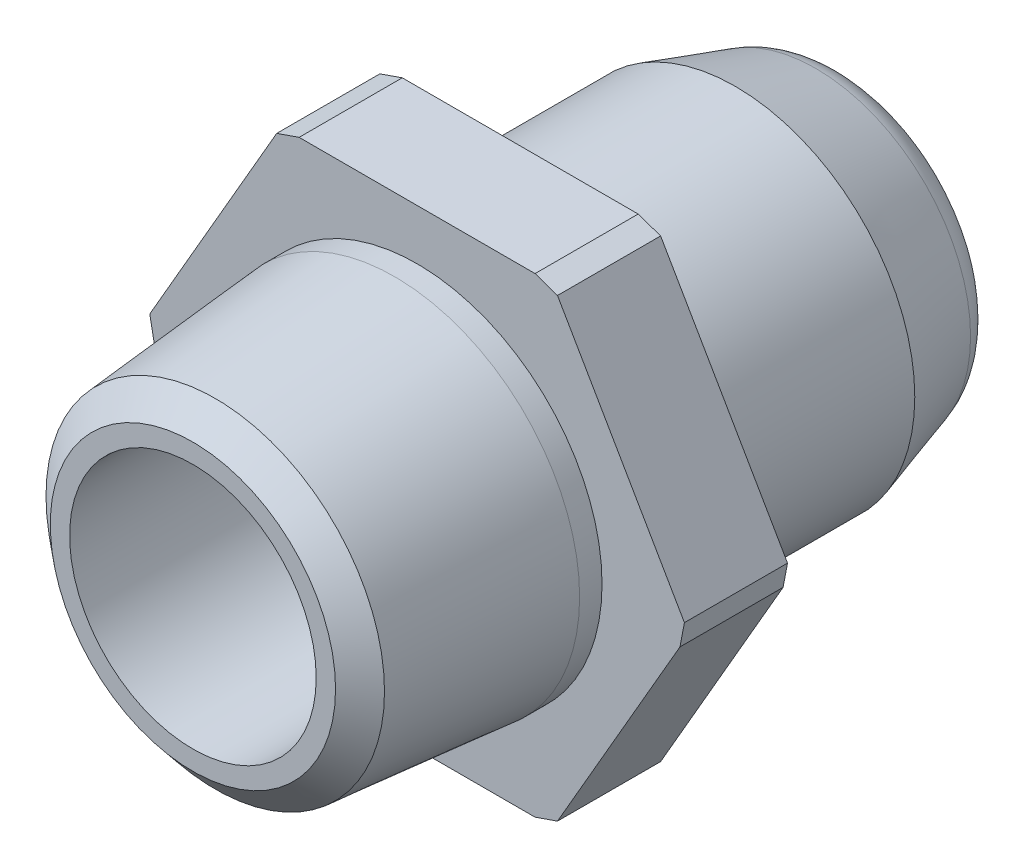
SolidWorks part; units mm, degrees
ref_plane "Front" through (0, 0, 0) normal (0, 0, 1) x (1, 0, 0)
ref_plane "Top" through (0, 0, 0) normal (0, 1, 0) x (1, 0, 0)
ref_plane "Right" through (0, 0, 0) normal (1, 0, 0) x (0, 0, -1)
sketch "Sketch1" plane through (0, 0, 0) normal (0, 0, 1) x (1, 0, 0)
  line L1 (15.3979, 0) -> (7.699, 13.335)
  line L2 (7.699, 13.335) -> (-7.699, 13.335)
  line L3 (-7.699, 13.335) -> (-15.3979, 0)
  line L4 (-15.3979, 0) -> (-7.699, -13.335)
  line L5 (-7.699, -13.335) -> (7.699, -13.335)
  line L6 (7.699, -13.335) -> (15.3979, 0)
  circle A0 centre (0, 0) radius 13.335 construction
  dimension "D1" = 26.67
extrude "Base-Extrude" add sketch "Sketch1" along normal mid plane 5.842
sketch "Sketch2" plane through (0, 0, 2.921) normal (0, 0, 1) x (1, 0, 0)
  circle A0 centre (0, 0) radius 10.4775
  dimension "D1" = 20.955
extrude "Boss-Extrude1" add sketch "Sketch2" along normal blind 1.27
sketch "Sketch3" plane through (0, 0, 4.191) normal (0, 0, 1) x (1, 0, 0)
  circle A1 centre (0, 0) radius 10.4775
  circle A2 centre (0, 0) radius 10.4775
  dimension "D1" = 0
extrude "Boss-Extrude2" add sketch "Sketch3" along normal blind 11.43 draft 5
sketch "Sketch4" plane through (0, 0, -2.921) normal (0, 0, -1) x (-1, 0, 0)
  circle A0 centre (0, 0) radius 10.16
  dimension "D1" = 20.32
extrude "Boss-Extrude3" add sketch "Sketch4" along normal blind 12.192
sketch "Sketch5" plane through (0, 0, -15.113) normal (0, 0, -1) x (-1, 0, 0)
  circle A1 centre (0, 0) radius 10.16
  circle A2 centre (0, 0) radius 10.16
  dimension "D1" = 0
extrude "Boss-Extrude4" add sketch "Sketch5" along normal blind 6.35 draft 17
fillet "Fillet1" radius 2.54
chamfer "Chamfer1" distance 1.016 distance2 0.508
chamfer "Chamfer2" distance 1.27 angle 45
sketch "Sketch6" plane through (0, 0, 15.621) normal (0, 0, 1) x (1, 0, 0)
  circle A0 centre (0, 0) radius 6.985
  dimension "D1" = 13.97
extrude "Cut-Extrude1" cut sketch "Sketch6" against normal blind 12.7
sketch "Sketch7" plane through (0, 0, 2.921) normal (0, 0, 1) x (1, 0, 0)
  circle A0 centre (0, 0) radius 6.096
  dimension "D1" = 12.192
extrude "Cut-Extrude2" cut sketch "Sketch7" against normal through all
